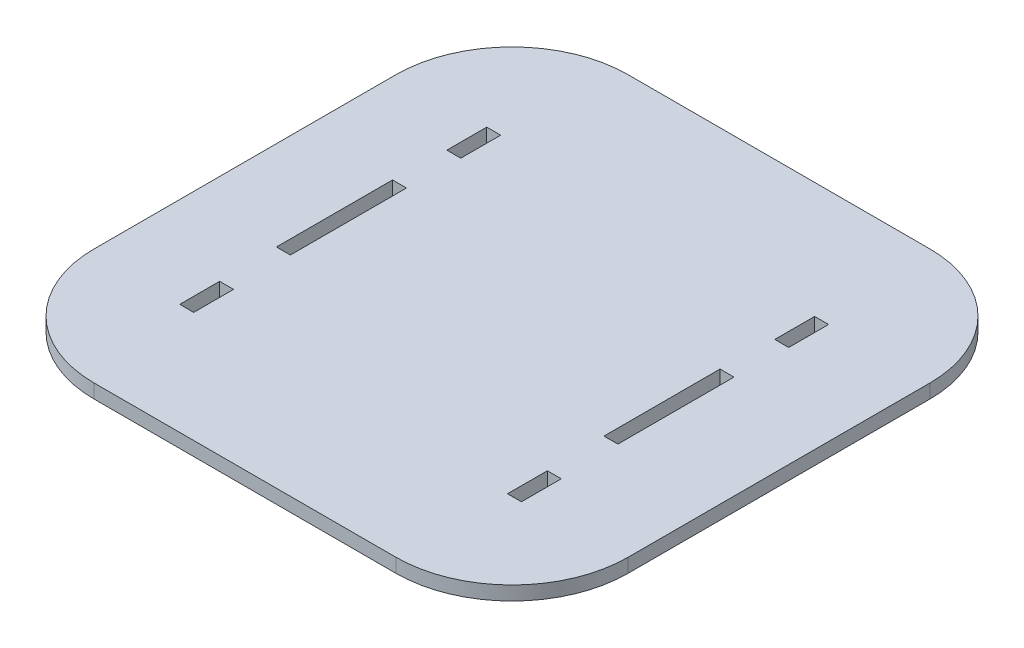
SolidWorks part; units mm, degrees
ref_plane "Front Plane" through (0, 0, 0) normal (0, 0, 1) x (1, 0, 0)
ref_plane "Top Plane" through (0, 0, 0) normal (0, 1, 0) x (1, 0, 0)
ref_plane "Right Plane" through (0, 0, 0) normal (1, 0, 0) x (0, 0, -1)
sketch "Sketch1" plane through (0, 0, 0) normal (0, 1, 0) x (1, 0, 0)
  line L0 (-38.7292, 315.4469) -> (-38.7292, 55.4469)
  line L1 (61.2708, -44.5531) -> (321.2708, -44.5531)
  line L2 (61.2708, 415.4469) -> (321.2708, 415.4469)
  line L3 (421.2708, 315.4469) -> (421.2708, 55.4469)
  arc A0 (-38.7292, 315.4469) -> (61.2708, 415.4469) centre (61.2708, 315.4469) cw
  arc A1 (421.2708, 315.4469) -> (321.2708, 415.4469) centre (321.2708, 315.4469) ccw
  arc A2 (321.2708, -44.5531) -> (421.2708, 55.4469) centre (321.2708, 55.4469) ccw
  arc A3 (61.2708, -44.5531) -> (-38.7292, 55.4469) centre (61.2708, 55.4469) cw
  dimension "D1" = 100
  dimension "D2" = 100
  dimension "D3" = 100
  dimension "D4" = 100
extrude "Boss-Extrude2" add sketch "Sketch1" along normal blind 12
sketch "Sketch2" plane through (0, 12, 0) normal (0, 1, 0) x (1, 0, 0)
  line L0 (321.9728, 315.4469) -> (321.9728, 281.1035)
  line L1 (39.5071, 315.4469) -> (39.5071, 281.1035)
  line L2 (51.5071, 51.0206) -> (51.5071, 85.364)
  line L3 (333.9728, 50.8756) -> (333.9728, 85.2125)
  line L4 (39.5071, 315.4469) -> (51.5071, 315.4469)
  line L5 (39.5071, 51.0206) -> (51.5071, 51.0206)
  line L6 (321.9728, 315.4469) -> (333.9728, 315.4469)
  line L7 (321.9728, 50.8756) -> (333.9728, 50.8756)
  line L8 (39.5071, 281.1035) -> (51.5071, 281.1035)
  line L9 (321.9728, 281.1035) -> (333.9728, 281.1035)
  line L10 (39.5071, 85.3704) -> (51.5071, 85.364)
  line L11 (321.9728, 85.219) -> (333.9728, 85.2125)
  line L12 (39.5071, 85.3704) -> (39.5071, 51.0206)
  line L13 (51.5071, 281.1035) -> (51.5071, 315.4469)
  line L14 (321.9728, 85.219) -> (321.9728, 50.8756)
  line L15 (333.9728, 281.1035) -> (333.9728, 315.4469)
extrude "Cut-Extrude1" cut sketch "Sketch2" against normal up to surface (12 mm away)
sketch "Sketch3" plane through (0, 12, 0) normal (0, 1, 0) x (1, 0, 0)
  line L0 (38.3494, 235.4469) -> (50.3494, 235.4469)
  line L1 (38.3494, 235.4469) -> (38.3494, 135.4469)
  line L2 (50.3494, 135.4469) -> (38.3494, 135.4469)
  line L3 (50.3494, 235.4469) -> (50.3494, 135.4469)
  line L4 (320.4873, 235.4469) -> (332.4873, 235.4469)
  line L7 (320.4873, 235.4469) -> (320.4873, 135.4469)
  line L8 (332.4873, 135.4469) -> (320.4873, 135.4469)
  line L9 (332.4873, 235.4469) -> (332.4873, 135.4469)
extrude "Cut-Extrude3" cut sketch "Sketch3" against normal up to surface (12 mm away)
